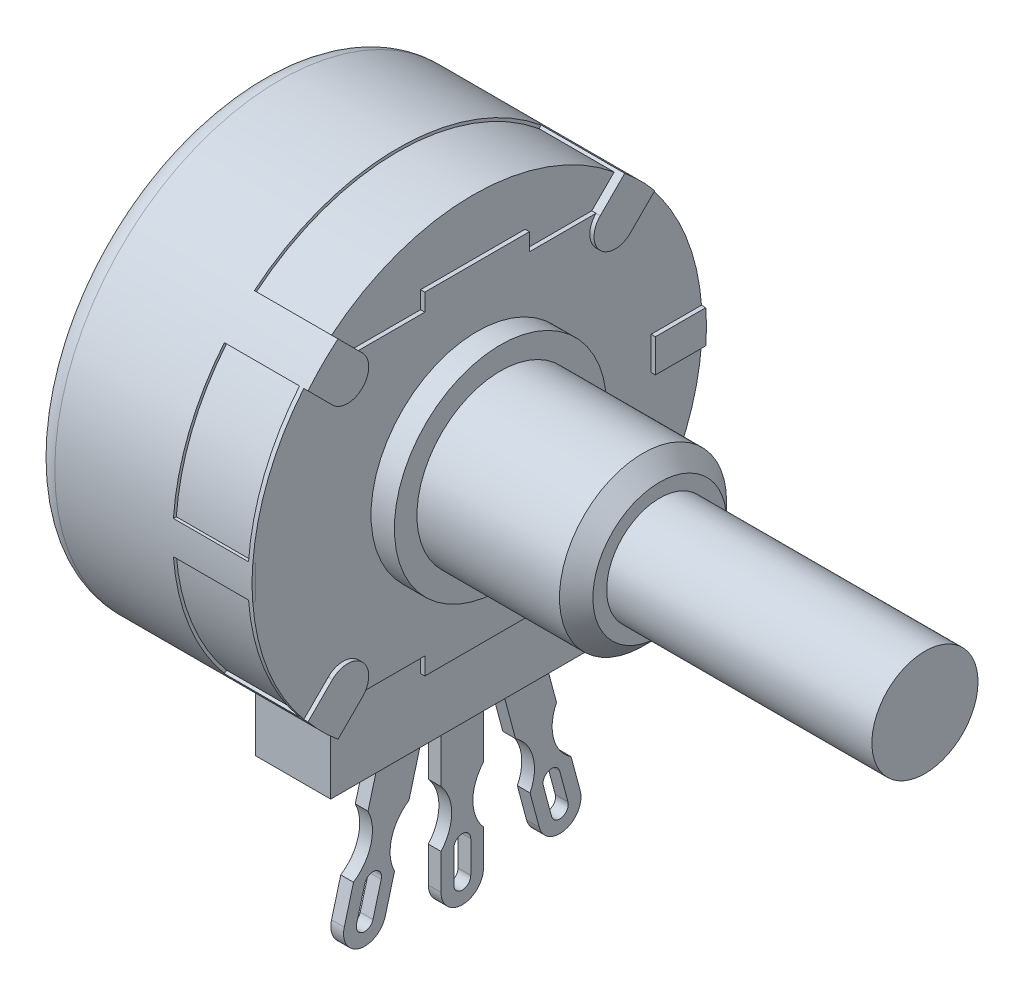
SolidWorks part; units mm, degrees
ref_plane "Front Plane" through (0, 0, 0) normal (0, 0, 1) x (1, 0, 0)
ref_plane "Top Plane" through (0, 0, 0) normal (0, 1, 0) x (1, 0, 0)
ref_plane "Right Plane" through (0, 0, 0) normal (1, 0, 0) x (0, 0, -1)
imported_body "Imported1"
sketch "Sketch1" plane through (17.7292, 0, 0) normal (1, 0, 0) x (0, 0, -1)
  line L0 (-14.4255, 0.9906) -> (-14.4255, -0.9906)
  line L1 (-14.4255, 0.9906) -> (-13.2508, 0.9906)
  line L3 (-14.4255, -0.9906) -> (-13.2508, -0.9906)
  line L4 (-13.2508, 0.9906) -> (-13.2508, -0.9906)
extrude "Cut-Extrude5" cut sketch "Sketch1" against normal blind 4.65
sketch "Sketch2" plane through (14.478, 0, 0) normal (1, 0, 0) x (0, 0, -1)
  circle A0 centre (0, 0) radius 5
extrude "Extrude1" add sketch "Sketch2" along normal blind 9.53
chamfer "Chamfer1" distance 1 angle 45 1 edges at (24.008, 0, -5)
